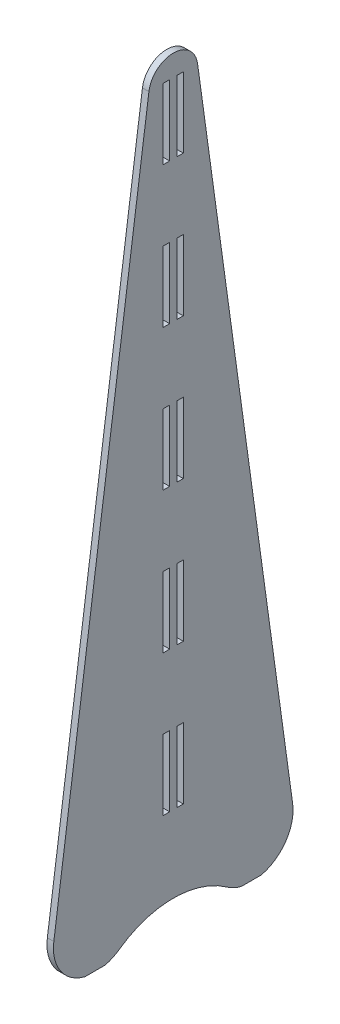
SolidWorks part; units mm, degrees
ref_plane "Plan de face" through (0, 0, 0) normal (0, 0, 1) x (1, 0, 0)
ref_plane "Plan de dessus" through (0, 0, 0) normal (0, 1, 0) x (1, 0, 0)
ref_plane "Plan de droite" through (0, 0, 0) normal (1, 0, 0) x (0, 0, -1)
sketch "Esquisse1" plane through (-178.6, 0, 0) normal (-1, 0, 0) x (0, 0, 1)
  line L0 (-3.2, 142) -> (-6.1, 142) construction
  line L2 (-1.6, -134) -> (-1.6, -176.2978) construction
  line L3 (2.9, -142) -> (0, -142)
  line L4 (0, -142) -> (0, -110.4444)
  line L5 (-6.1, -47.3333) -> (-6.1, -78.8889) construction
  line L6 (-6.1, -78.8889) -> (-3.2, -78.8889) construction
  line L7 (-3.2, -78.8889) -> (-3.2, -47.3333) construction
  line L8 (-3.2, -47.3333) -> (-6.1, -47.3333) construction
  line L9 (-6.1, 15.7778) -> (-6.1, -15.7778) construction
  line L10 (-6.1, -15.7778) -> (-3.2, -15.7778) construction
  line L11 (-3.2, -15.7778) -> (-3.2, 15.7778) construction
  line L12 (-3.2, 15.7778) -> (-6.1, 15.7778) construction
  line L13 (-6.1, 78.8889) -> (-6.1, 47.3333) construction
  line L14 (-6.1, 47.3333) -> (-3.2, 47.3333) construction
  line L15 (-3.2, 47.3333) -> (-3.2, 78.8889) construction
  line L16 (-3.2, 78.8889) -> (-6.1, 78.8889) construction
  line L17 (-6.1, 142) -> (-6.1, 110.4444) construction
  line L18 (-6.1, 110.4444) -> (-3.2, 110.4444) construction
  line L19 (-3.2, 110.4444) -> (-3.2, 142) construction
  line L24 (-6.1, -47.3333) -> (-6.1, -78.8889)
  line L25 (-6.1, -78.8889) -> (-3.2, -78.8889)
  line L26 (-3.2, -78.8889) -> (-3.2, -47.3333)
  line L27 (-3.2, -47.3333) -> (-6.1, -47.3333)
  line L28 (-6.1, 15.7778) -> (-6.1, -15.7778)
  line L29 (-6.1, -15.7778) -> (-3.2, -15.7778)
  line L30 (-3.2, -15.7778) -> (-3.2, 15.7778)
  line L31 (-3.2, 15.7778) -> (-6.1, 15.7778)
  line L32 (-6.1, 78.8889) -> (-6.1, 47.3333)
  line L33 (-6.1, 47.3333) -> (-3.2, 47.3333)
  line L34 (-3.2, 47.3333) -> (-3.2, 78.8889)
  line L35 (-3.2, 78.8889) -> (-6.1, 78.8889)
  line L36 (-6.1, 142) -> (-6.1, 110.4444)
  line L37 (-6.1, 110.4444) -> (-3.2, 110.4444)
  line L38 (-3.2, 110.4444) -> (-3.2, 142)
  line L39 (-3.2, 142) -> (-6.1, 142)
  line L40 (-3.2, 142) -> (0, 142) construction
  line L41 (-1.6, 142) -> (-1.6, -131) construction
  line L42 (2.9, -110.4444) -> (2.9, -142)
  line L43 (0, 78.8889) -> (2.9, 78.8889)
  line L44 (0, 47.3333) -> (0, 78.8889)
  line L45 (2.9, 47.3333) -> (0, 47.3333)
  line L46 (2.9, 78.8889) -> (2.9, 47.3333)
  line L47 (0, 15.7778) -> (2.9, 15.7778)
  line L48 (0, -15.7778) -> (0, 15.7778)
  line L49 (2.9, -15.7778) -> (0, -15.7778)
  line L50 (2.9, 15.7778) -> (2.9, -15.7778)
  line L51 (0, -47.3333) -> (2.9, -47.3333)
  line L52 (0, -78.8889) -> (0, -47.3333)
  line L53 (2.9, -78.8889) -> (0, -78.8889)
  line L54 (2.9, -47.3333) -> (2.9, -78.8889)
  line L55 (0, -110.4444) -> (2.9, -110.4444)
  line L58 (0, 142) -> (2.9, 142)
  line L59 (0, 110.4444) -> (0, 142)
  line L60 (2.9, 110.4444) -> (0, 110.4444)
  line L61 (2.9, 142) -> (2.9, 110.4444)
  line L74 (-6.1, 142) -> (-6.1, 149.1096) construction
  line L75 (-6.1, 142) -> (-13.2096, 142) construction
  line L76 (-32.1, -187) -> (-41.1, -187)
  line L78 (28.9, -187) -> (37.9, -187)
  line L79 (-3.2, -110.4444) -> (-3.2, -142) construction
  line L86 (-3.2, -142) -> (-3.2, -110.4444)
  line L87 (-6.1, -110.4444) -> (-6.1, -142)
  line L88 (-6.1, -142) -> (-3.2, -142)
  line L89 (-3.2, -142) -> (-3.2, -110.4444)
  line L90 (-3.2, -110.4444) -> (-6.1, -110.4444)
  line L91 (-6.1, -110.4444) -> (-6.1, -142)
  line L92 (-6.1, -142) -> (-3.2, -142)
  line L94 (-3.2, -110.4444) -> (-6.1, -110.4444)
  line L95 (51.8786, -166.345) -> (9.2966, 142)
  line L96 (-55.0786, -166.345) -> (-12.4966, 142)
  arc A2 (-1.6, 151.4952) -> (9.2966, 142) centre (-1.6, 140.4952) cw
  arc A3 (-1.6, 151.4952) -> (-12.4966, 142) centre (-1.6, 140.4952) ccw
  arc A13 (-55.0786, -166.345) -> (-41.1, -187) centre (-36.6, -168.8969) ccw
  arc A14 (-25.7286, -184.0556) -> (22.5286, -184.0556) centre (-1.6, -217.6996) cw
  arc A15 (-32.1, -187) -> (-25.7286, -184.0556) centre (-36.6, -168.8969) ccw
  arc A17 (51.8786, -166.345) -> (37.9, -187) centre (33.4, -168.8969) cw
  arc A18 (28.9, -187) -> (22.5286, -184.0556) centre (33.4, -168.8969) cw
  point P24 (0, 0)
  point P38 (0, -141.7212)
  dimension "D1" = 18.654
  dimension "D3" = 11
  dimension "D6" = 70
  dimension "D7" = 41.4018
  dimension "D4" = 0
  dimension "D5" = 9
  dimension "D8" = 45
extrude "Boss.-Extru.2" add sketch "Esquisse1" against normal blind 2.9
